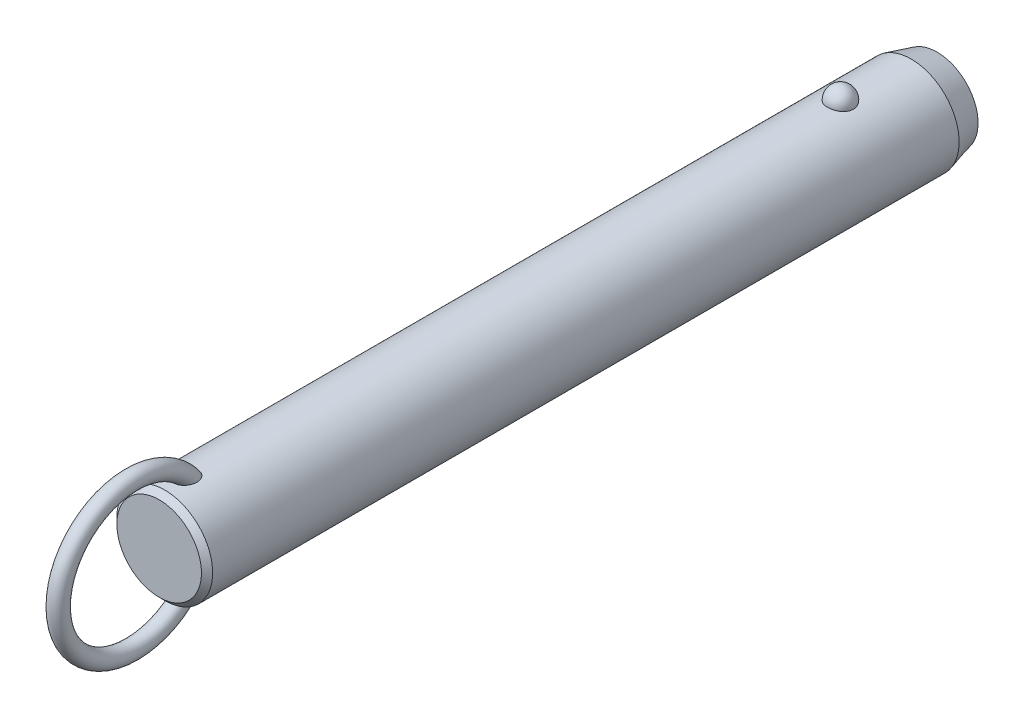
SolidWorks part; units mm, degrees
ref_plane "Front Plane" through (0, 0, 0) normal (0, 0, 1) x (1, 0, 0)
ref_plane "Top Plane" through (0, 0, 0) normal (0, 1, 0) x (1, 0, 0)
ref_plane "Right Plane" through (0, 0, 0) normal (1, 0, 0) x (0, 0, -1)
sketch "Sketch2" plane through (0, 0, 0) normal (0, 0, 1) x (1, 0, 0)
  circle A0 centre (0, 0) radius 11.1
  point P3 (0, 11.1)
  dimension "D1" = 22.2
extrude "Boss-Extrude1" add sketch "Sketch2" along normal blind 142.2
sketch "Sketch3" plane through (0, 0, 0) normal (0, 0, -1) x (-1, 0, 0)
  circle A0 centre (0, 0) radius 11.1
  dimension "D1" = 22.2
extrude "Boss-Extrude2" add sketch "Sketch3" along normal blind 25.4
chamfer "Chamfer1" distance 6 angle 15 1 edges at (-11.1, 0, -25.4)
sketch "Sketch12" plane through (0, 0, 0) normal (1, 0, 0) x (0, 0, -1)
  line L0 (-142.2, 11.1) -> (-142.2, -11.1) construction
  point P0 (-142.2, 0)
sketch "Sketch13" plane through (0, 0, 0) normal (1, 0, 0) x (0, 0, -1)
  circle A0 centre (-161.25, 0) radius 19.05
  point P2 (-142.2, 0)
  dimension "D1" = 38.1
sketch "Sketch14" plane through (0, 0, 0) normal (0, 1, 0) x (1, 0, 0)
  circle A0 centre (0, -144.2) radius 2
  point P2 (0, -142.2)
  dimension "D1" = 4
sweep "Sweep1" add profiles "Sketch14" path "Sketch13"
sketch "Sketch15" plane through (0, 0, 142.2) normal (0, 0, 1) x (1, 0, 0)
  circle A0 centre (0, 0) radius 11.1
  dimension "D1" = 22.2
extrude "Boss-Extrude3" add sketch "Sketch15" along normal blind 12.7
chamfer "Chamfer2" distance 1.3 angle 45 1 edges at (11.1, 0, 154.9)
sketch "Sketch18" plane through (0, 0, 0) normal (1, 0, 0) x (0, 0, -1)
  line L0 (19.4, 11.1) -> (-145.768, 11.1) construction
  line L1 (3, 14.1) -> (3, 8.1)
  line L2 (-145.768, -11.1) -> (19.4, -11.1) construction
  arc A0 (3, 14.1) -> (3, 8.1) centre (3, 11.1) ccw
  point P4 (0, 11.1)
  dimension "D1" = 25.2
revolve "Revolve1" add sketch "Sketch18" angle 360 about L1
